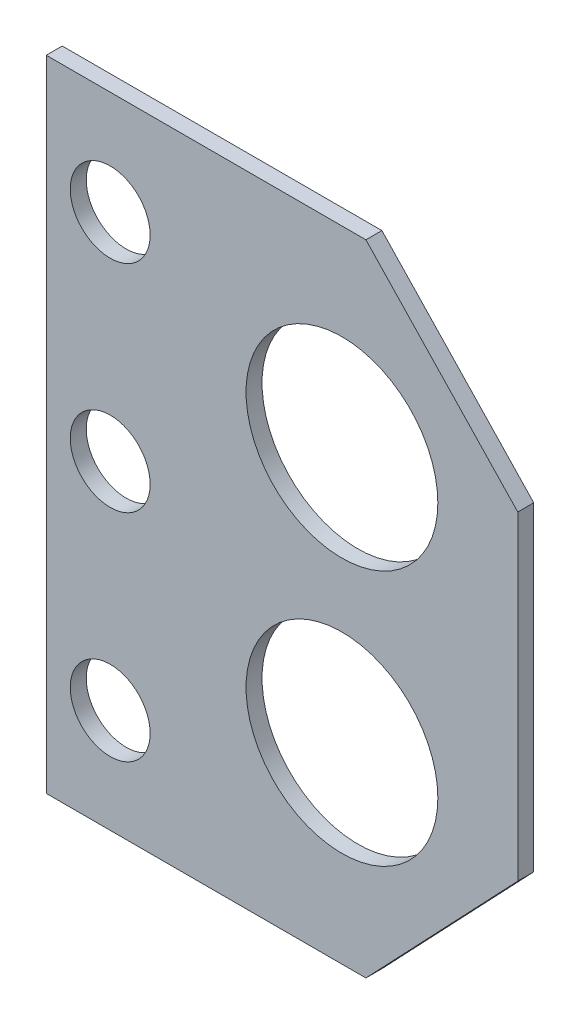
SolidWorks part; units mm, degrees
ref_plane "Plan de face" through (0, 0, 0) normal (0, 0, 1) x (1, 0, 0)
ref_plane "Plan de dessus" through (0, 0, 0) normal (0, 1, 0) x (1, 0, 0)
ref_plane "Plan de droite" through (0, 0, 0) normal (1, 0, 0) x (0, 0, -1)
sketch "Esquisse1" plane through (0, 0, 0) normal (0, 0, 1) x (1, 0, 0)
  line L0 (0, 0) -> (0, 400)
  line L1 (0, 400) -> (200, 400)
  line L2 (200, 400) -> (295, 300)
  line L3 (295, 300) -> (295, 100)
  line L4 (295, 100) -> (200, 0)
  line L5 (200, 0) -> (0, 0)
  dimension "D1" = 400
  dimension "D2" = 200
  dimension "D3" = 200
  dimension "D4" = 95
extrude "Boss.-Extru.1" add sketch "Esquisse1" along normal blind 10
sketch "Esquisse2" plane through (0, 0, 10) normal (0, 0, 1) x (1, 0, 0)
  line L0 (0, 200) -> (295, 200) construction
  line L1 (0, 400) -> (0, 0) construction
  line L2 (295, 100) -> (295, 300) construction
  circle A0 centre (40, 335) radius 25
  circle A1 centre (40, 200) radius 25
  circle A2 centre (40, 65) radius 25
  circle A3 centre (185, 280) radius 60
  circle A4 centre (185, 120) radius 60
  dimension "D1" = 135
  dimension "D2" = 135
  dimension "D4" = 110
  dimension "D5" = 80
  dimension "D6" = 80
  dimension "D7" = 120
  dimension "D8" = 50
  dimension "D3" = 40
extrude "Enlèv. mat.-Extru.1" cut sketch "Esquisse2" against normal through all
